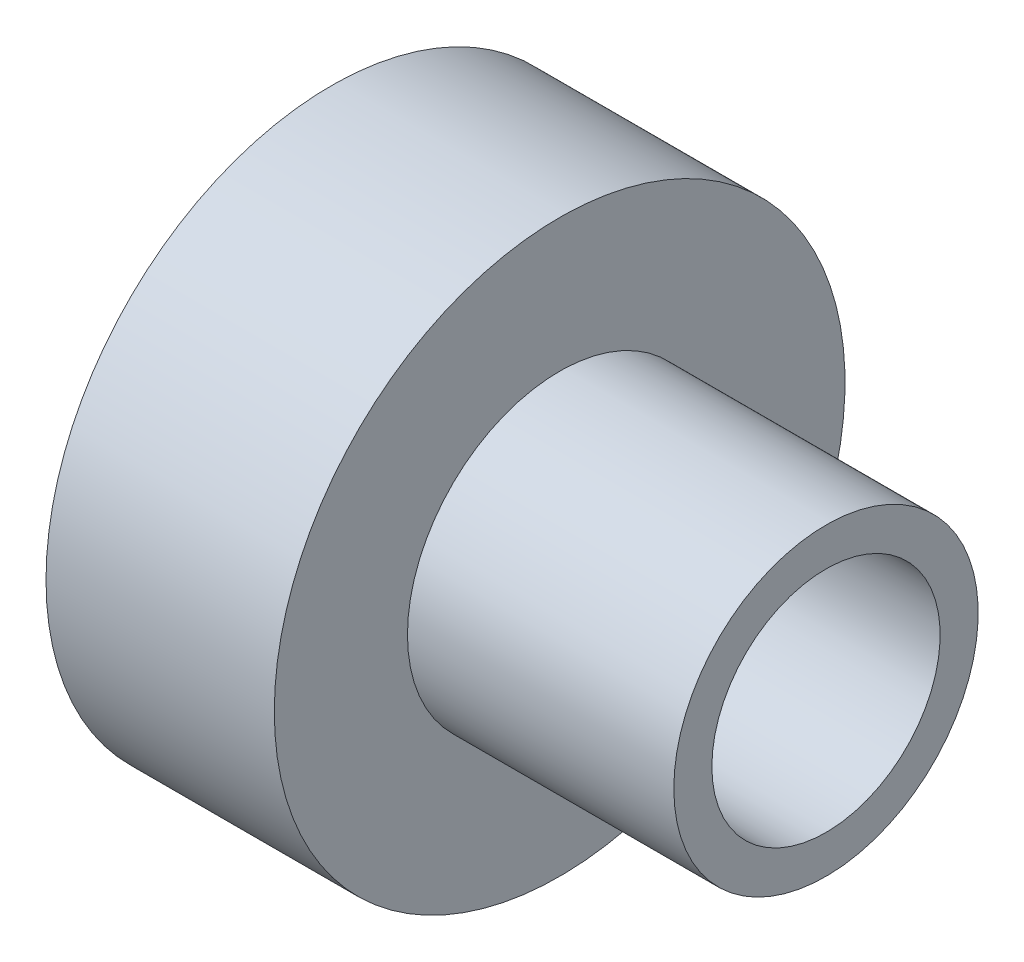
SolidWorks part; units mm, degrees
ref_plane "Front Plane" through (0, 0, 0) normal (0, 0, 1) x (1, 0, 0)
ref_plane "Top Plane" through (0, 0, 0) normal (0, 1, 0) x (1, 0, 0)
ref_plane "Right Plane" through (0, 0, 0) normal (1, 0, 0) x (0, 0, -1)
sketch "Sketch1" plane through (0, 0, 0) normal (0, 0, 1) x (1, 0, 0)
  line L0 (0, 0) -> (35.5513, 0) construction
  line L1 (8.7107, 3) -> (21.7107, 3)
  line L2 (21.7107, 3) -> (21.7107, 4)
  line L3 (21.7107, 4) -> (14.7107, 4)
  line L4 (14.7107, 4) -> (14.7107, 7.5)
  line L5 (14.7107, 7.5) -> (8.7107, 7.5)
  line L6 (8.7107, 7.5) -> (8.7107, 3)
  dimension "D1" = 7.5
  dimension "D2" = 4
  dimension "D3" = 6
  dimension "D4" = 6
  dimension "D5" = 7
revolve "Revolve1" add sketch "Sketch1" angle 360 about L0
